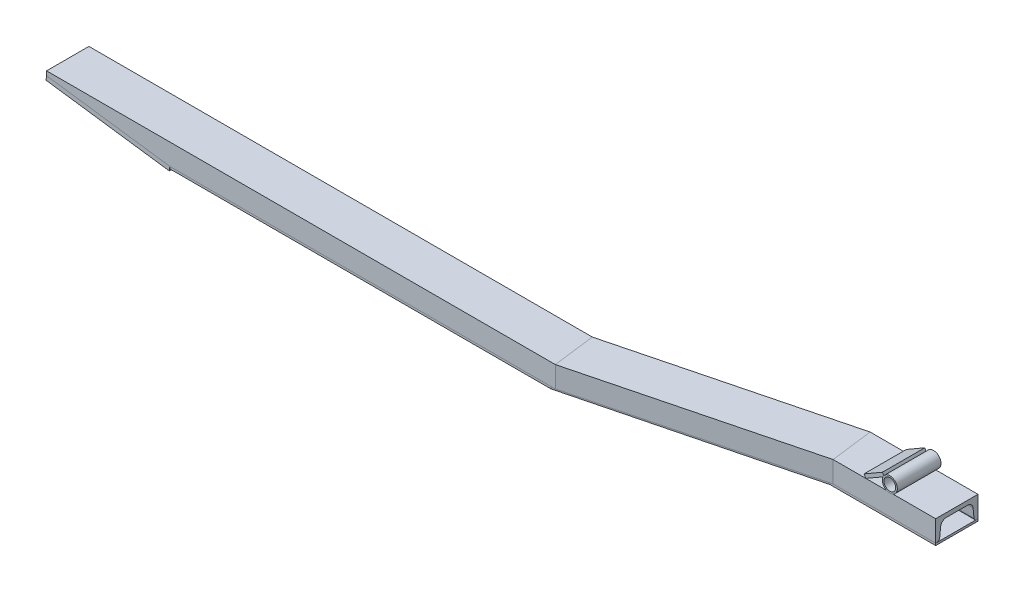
SolidWorks part; units mm, degrees
ref_plane "Plan de face" through (0, 0, 0) normal (0, 0, 1) x (1, 0, 0)
ref_plane "Plan de dessus" through (0, 0, 0) normal (0, 1, 0) x (1, 0, 0)
ref_plane "Plan de droite" through (0, 0, 0) normal (1, 0, 0) x (0, 0, -1)
sketch "Esquisse1" plane through (0, 0, 0) normal (0, 1, 0) x (1, 0, 0)
  line L0 (0, 0) -> (0, -60)
  line L1 (0, -60) -> (-150, -60)
  line L2 (-150, -60) -> (-465.2, -140.3)
  line L3 (-465.2, -140.3) -> (-1005.2, -140.3)
  line L4 (-1005.2, -140.3) -> (-1005.2, -80.3)
  line L5 (-1005.2, -80.3) -> (-466.4, -80.3)
  line L6 (-466.4, -80.3) -> (-152.9, 0)
  line L7 (-152.9, 0) -> (0, 0)
  dimension "D1" = 1005.2
  dimension "D2" = 540
  dimension "D3" = 538.8
  dimension "D4" = 152.9
  dimension "D5" = 150
  dimension "D6" = 60
  dimension "D7" = 80.3
extrude "Extrusion1" add sketch "Esquisse1" along normal blind 3
sketch "Esquisse2" [suppressed] plane through (0, 0, 0) normal (0, -1, 0) x (1, 0, 0)
  line L0 (0, 0) -> (-152.9, 0)
  line L1 (-152.9, 0) -> (-233.2, 80.3)
  line L2 (-233.2, 80.3) -> (-590, 80.3)
  dimension "D1" = 590
other "Elément mécano-soudé1"
ref_plane "Plan1" through (0, 0, 0) normal (-1, 0, 0) x (0, 0, 1)
sketch "Sketch1" plane through (0, -30, 60) normal (-1, 0, 0) x (0, 1, 0)
  line L0 (30, 60) -> (0, 60)
  line L1 (30, 0) -> (0, 0)
  line L2 (0, 60) -> (0, 0)
  line L3 (14, 45) -> (14, 15) construction
  line L4 (0, 30) -> (14, 30) construction
  line L6 (30, 60) -> (30, 58.3274)
  line L7 (30, 0) -> (30, 1.6726)
  line L12 (6, 45) -> (6, 15)
  line L17 (13.1638, 52.9562) -> (26.4181, 54.3493)
  line L18 (13.1638, 7.0438) -> (26.4181, 5.6507)
  arc A0 (26.4181, 54.3493) -> (30, 58.3274) centre (26, 58.3274) ccw
  arc A1 (26.4181, 5.6507) -> (30, 1.6726) centre (26, 1.6726) cw
  arc A9 (6, 15) -> (13.1638, 7.0438) centre (14, 15) ccw
  arc A10 (6, 45) -> (13.1638, 52.9562) centre (14, 45) cw
  point P8 (0, 30)
  point P9 (6, 30)
  point P10 (15, 60)
  point P11 (15, 0)
  point P12 (30, 5.2743)
  point P13 (30, 54.7257)
  point P16 (0, 0)
  dimension "D4" = 4
  dimension "RI" = 8
  dimension "D2" = 6
  dimension "Depth" = 60
  dimension "BF" = 30
  dimension "TW" = 6
  dimension "d1" = 30
sketch "Esquisse4" [suppressed] plane through (0, 0, 140.3) normal (0, 0, 1) x (1, 0, 0)
  line L0 (-590, -24) -> (-502.6, 0)
  line L1 (-502.6, 0) -> (-590, 0)
  line L2 (-590, 0) -> (-590, -24)
extrude "Enlèv. mat.-Extru.1" [suppressed] cut sketch "Esquisse4" against normal through all
sketch "Esquisse5" [suppressed] plane through (-35.2412, 128.3365, 0) normal (-0.2648, 0.9643, 0) x (-0.9643, -0.2648, 0)
  line L0 (575.2945, 80.3) -> (484.6592, 80.3)
other "Elément mécano-soudé2"
ref_plane "Plan2" through (-590, -24, 80.3) normal (0.9643, 0.2648, 0) x (0, 0, -1)
sketch "Esquisse11" plane through (-590.7944, -21.1071, 110.3) normal (0.9643, 0.2648, 0) x (0, 0, -1)
  line L0 (0, 3) -> (0, -3) construction
  line L1 (-30, 3) -> (30, 3)
  line L2 (-30, 3) -> (-30, -3)
  line L3 (-30, -3) -> (30, -3)
  line L4 (30, 3) -> (30, -3)
  line L5 (-30, 0) -> (30, 0) construction
  point P9 (0, 0)
  dimension "D1" = 60
  dimension "D2" = 6
sketch "Esquisse12" plane through (0, 3, 0) normal (0, 1, 0) x (-1, 0, 0)
  line L0 (0, 0) -> (152.9, 0)
  line L1 (152.9, 0) -> (466.4, 80.3)
  line L2 (466.4, 80.3) -> (1180, 80.3)
  dimension "D1" = 1180
other "Elément mécano-soudé3"
ref_plane "Plan3" through (0, 3, 0) normal (-1, 0, 0) x (0, 0, 1)
sketch "Sketch11" plane through (0, 33, 0) normal (-1, 0, 0) x (0, -1, 0)
  line L0 (30, 60) -> (0, 60)
  line L1 (30, 0) -> (0, 0)
  line L2 (0, 60) -> (0, 0)
  line L3 (14, 45) -> (14, 15) construction
  line L4 (0, 30) -> (14, 30) construction
  line L6 (30, 60) -> (30, 58.3274)
  line L7 (30, 0) -> (30, 1.6726)
  line L12 (6, 45) -> (6, 15)
  line L17 (13.1638, 52.9562) -> (26.4181, 54.3493)
  line L18 (13.1638, 7.0438) -> (26.4181, 5.6507)
  arc A0 (26.4181, 54.3493) -> (30, 58.3274) centre (26, 58.3274) ccw
  arc A1 (26.4181, 5.6507) -> (30, 1.6726) centre (26, 1.6726) cw
  arc A9 (6, 15) -> (13.1638, 7.0438) centre (14, 15) ccw
  arc A10 (6, 45) -> (13.1638, 52.9562) centre (14, 45) cw
  point P8 (0, 30)
  point P9 (6, 30)
  point P10 (15, 60)
  point P11 (15, 0)
  point P12 (30, 5.2743)
  point P13 (30, 54.7257)
  point P16 (0, 0)
  dimension "D4" = 4
  dimension "RI" = 8
  dimension "D2" = 6
  dimension "Depth" = 60
  dimension "BF" = 30
  dimension "TW" = 6
  dimension "d1" = 30
sketch "Esquisse14" plane through (0, 0, 140.3) normal (0, 0, 1) x (1, 0, 0)
  line L0 (-1005.2, 3) -> (-1180, 27)
  line L1 (-1180, 27) -> (-1180, 3)
  line L2 (-1180, 3) -> (-1005.2, 3)
extrude "Enlèv. mat.-Extru.2" cut sketch "Esquisse14" against normal through all
sketch "Esquisse15" plane through (-18.1944, -132.5156, 0) normal (-0.136, -0.9907, 0) x (0.9907, -0.136, 0)
  line L0 (-1172.7052, 140.3) -> (-996.2653, 140.3)
other "Elément mécano-soudé4"
ref_plane "Plan4" through (-1180, 27, 140.3) normal (0.9907, -0.136, 0) x (0, 0, -1)
sketch "Esquisse17" plane through (-1180.4081, 24.0279, 110.3) normal (0.9907, -0.136, 0) x (0, 0, -1)
  line L0 (0, 3) -> (0, -3) construction
  line L1 (-30, 3) -> (30, 3)
  line L2 (-30, 3) -> (-30, -3)
  line L3 (-30, -3) -> (30, -3)
  line L4 (30, 3) -> (30, -3)
  line L5 (-30, 0) -> (30, 0) construction
  point P9 (0, 0)
  dimension "D1" = 60
  dimension "D2" = 6
sketch "Esquisse18" plane through (0, 33, 0) normal (0, 1, 0) x (-1, 0, 0)
  line L0 (64, -1) -> (64, 61)
  line L3 (0, 60) -> (0, 0) construction
  line L4 (152.9, 0) -> (0, 0) construction
  line L5 (145.3379, 60) -> (0, 60) construction
  dimension "D1" = 64
  dimension "D2" = 1
  dimension "D3" = 1
other "Elément mécano-soudé5"
ref_plane "Plan5" through (-64, 33, -1) normal (0, 0, 1) x (1, 0, 0)
sketch "Esquisse19" plane through (-64, 43.65, -1) normal (0, 0, 1) x (1, 0, 0)
  line L0 (-10.65, 0) -> (10.65, 0) construction
  line L1 (0, 10.65) -> (0, -10.65) construction
  circle A0 centre (0, 0) radius 10.65
  circle A1 centre (0, 0) radius 8.35
  point P8 (0, 0)
  dimension "D1" = 16.7
  dimension "D2" = 21.3
sketch "Esquisse20" plane through (0, 33, 0) normal (0, 1, 0) x (-1, 0, 0)
  line L0 (99, 0) -> (99, 60)
  line L1 (152.9, 0) -> (0, 0) construction
  line L2 (145.3379, 60) -> (0, 60) construction
  line L3 (0, 60) -> (0, 0) construction
  dimension "D1" = 99
other "Elément mécano-soudé6"
ref_plane "Plan6" through (-99, 33, 0) normal (0, 0, 1) x (1, 0, 0)
sketch "Esquisse110" plane through (-87.2596, 42.6651, 0) normal (0, 0, 1) x (0.866, 0.5, 0)
  line L0 (0, 2.5) -> (0, -2.5) construction
  line L1 (-15, 2.5) -> (15, 2.5)
  line L2 (-15, 2.5) -> (-15, -2.5)
  line L3 (-15, -2.5) -> (15, -2.5)
  line L4 (15, 2.5) -> (15, -2.5)
  line L5 (-15, 0) -> (15, 0) construction
  point P8 (0, 0)
  dimension "D1" = 30
  dimension "D2" = 5
sketch "Esquisse111" [suppressed] plane through (0, -30, 0) normal (0, -1, 0) x (1, 0, 0)
  line L0 (-64, -1) -> (-64, 61)
  line L1 (0, 0) -> (0, 60) construction
  line L2 (-152.9, 0) -> (0, 0) construction
  line L3 (-128.0472, 60) -> (0, 60) construction
  dimension "D1" = 64
  dimension "D2" = 1
  dimension "D3" = 1
other "Elément mécano-soudé7"
ref_plane "Plan7" through (-64, -30, -1) normal (0, 0, 1) x (1, 0, 0)
sketch "Esquisse113" plane through (-64, -40.65, -1) normal (0, 0, 1) x (1, 0, 0)
  line L0 (-10.65, 0) -> (10.65, 0) construction
  line L1 (0, 10.65) -> (0, -10.65) construction
  circle A0 centre (0, 0) radius 10.65
  circle A1 centre (0, 0) radius 8.35
  point P8 (0, 0)
  dimension "D1" = 16.7
  dimension "D2" = 21.3
sketch "Esquisse114" [suppressed] plane through (0, -30, 0) normal (0, -1, 0) x (1, 0, 0)
  line L0 (-99, 0) -> (-99, 60)
  line L1 (-152.9, 0) -> (0, 0) construction
  line L2 (-128.0472, 60) -> (0, 60) construction
  line L3 (0, 0) -> (0, 60) construction
  dimension "D1" = 99
other "Elément mécano-soudé8"
ref_plane "Plan8" through (-99, -30, 0) normal (0, 0, 1) x (1, 0, 0)
sketch "Esquisse115" plane through (-87.2596, -39.6651, 0) normal (0, 0, 1) x (0.866, -0.5, 0)
  line L0 (0, 2.5) -> (0, -2.5) construction
  line L1 (-15, 2.5) -> (15, 2.5)
  line L2 (-15, 2.5) -> (-15, -2.5)
  line L3 (-15, -2.5) -> (15, -2.5)
  line L4 (15, 2.5) -> (15, -2.5)
  line L5 (-15, 0) -> (15, 0) construction
  point P8 (0, 0)
  dimension "D1" = 30
  dimension "D2" = 5
